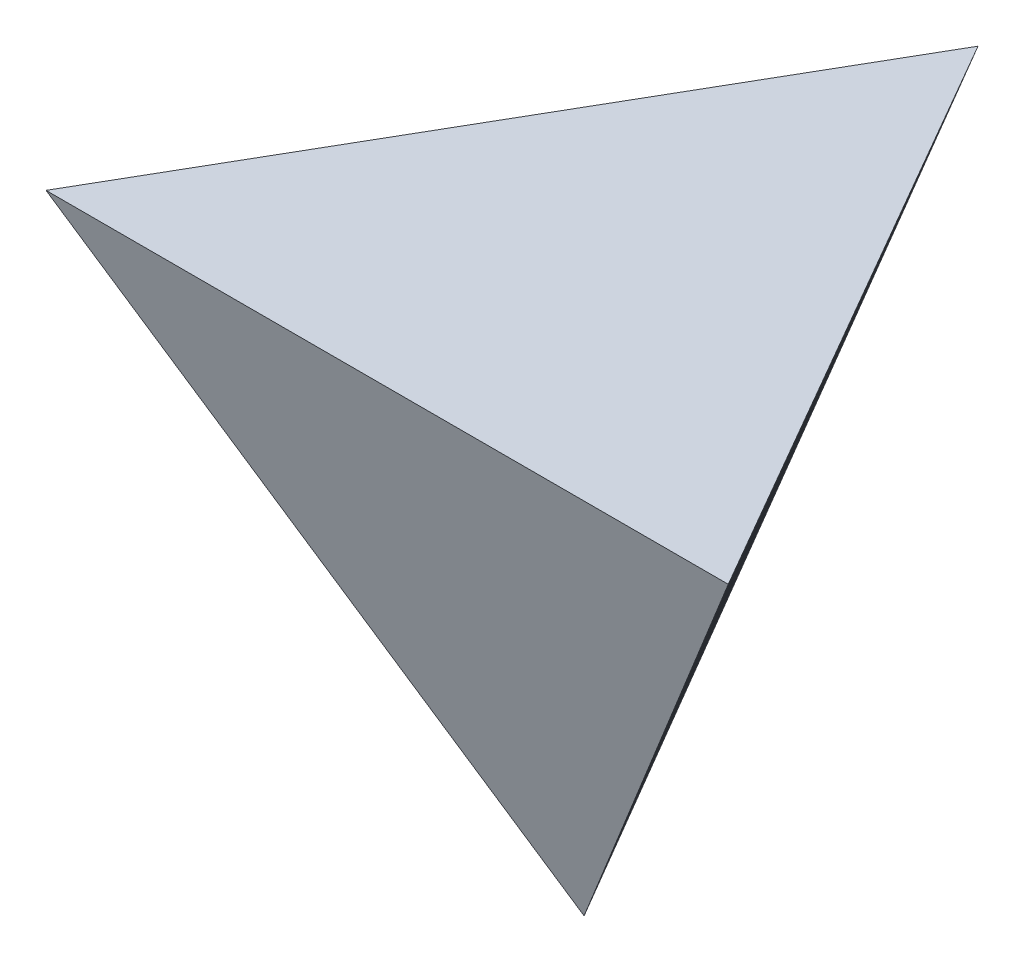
SolidWorks part; units mm, degrees
ref_plane "Front Plane" through (0, 0, 0) normal (0, 0, 1) x (1, 0, 0)
ref_plane "Top Plane" through (0, 0, 0) normal (0, 1, 0) x (1, 0, 0)
ref_plane "Right Plane" through (0, 0, 0) normal (1, 0, 0) x (0, 0, -1)
sketch "Sketch1" plane through (0, 0, 0) normal (0, 1, 0) x (1, 0, 0)
  line L0 (0, 0) -> (25, 0)
  line L1 (0, 0) -> (-25, 0)
  line L2 (-25, 0) -> (0, 43.3013)
  line L3 (25, 0) -> (0, 43.3013)
extrude "Boss-Extrude1" add sketch "Sketch1" along normal blind 50
draft "Draft2" type of draft neutral plane draft angle 19.5 faces to draft 3 parameters "D1"=19.5
